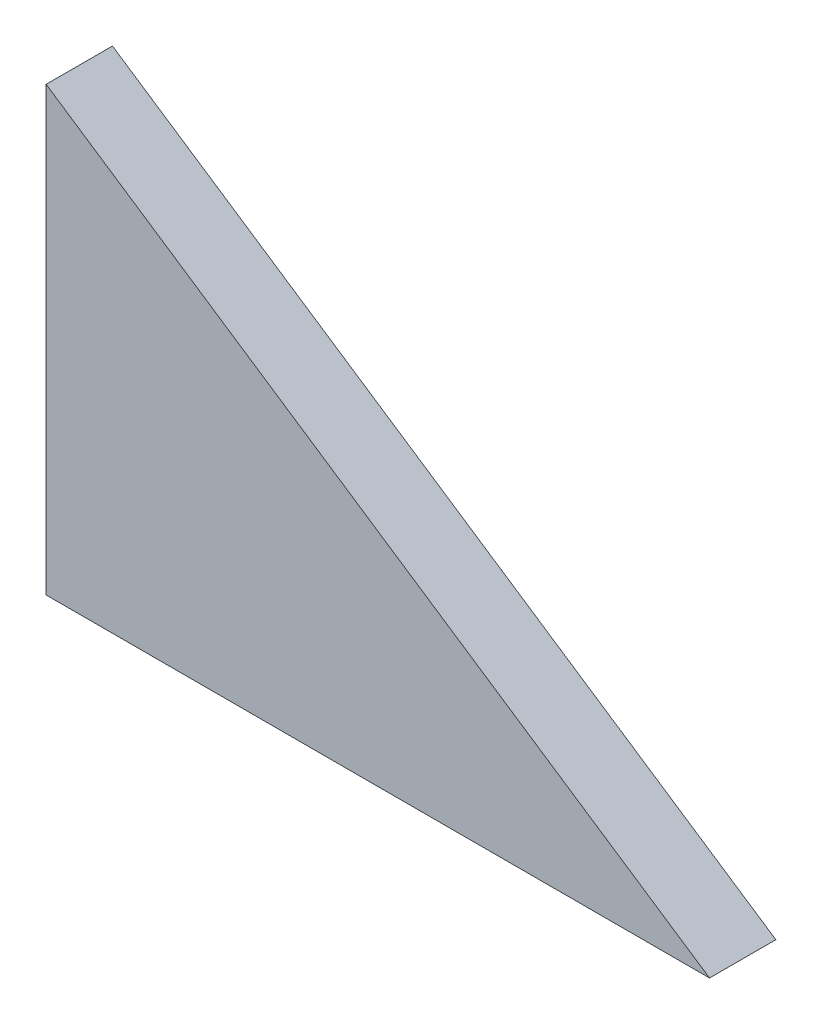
SolidWorks part; units mm, degrees
ref_plane "Face" through (0, 0, 0) normal (0, 0, 1) x (1, 0, 0)
ref_plane "Dessus" through (0, 0, 0) normal (0, 1, 0) x (1, 0, 0)
ref_plane "Droite" through (0, 0, 0) normal (1, 0, 0) x (0, 0, -1)
sketch "Esquisse1" plane through (0, 0, 0) normal (0, 0, 1) x (1, 0, 0)
  line L0 (0, 0) -> (0, 20)
  line L1 (0, 20) -> (30, 0)
  line L2 (30, 0) -> (0, 0)
  dimension "D1" = 30
  dimension "D2" = 20
extrude "Extrusion1" add sketch "Esquisse1" along normal blind 3
